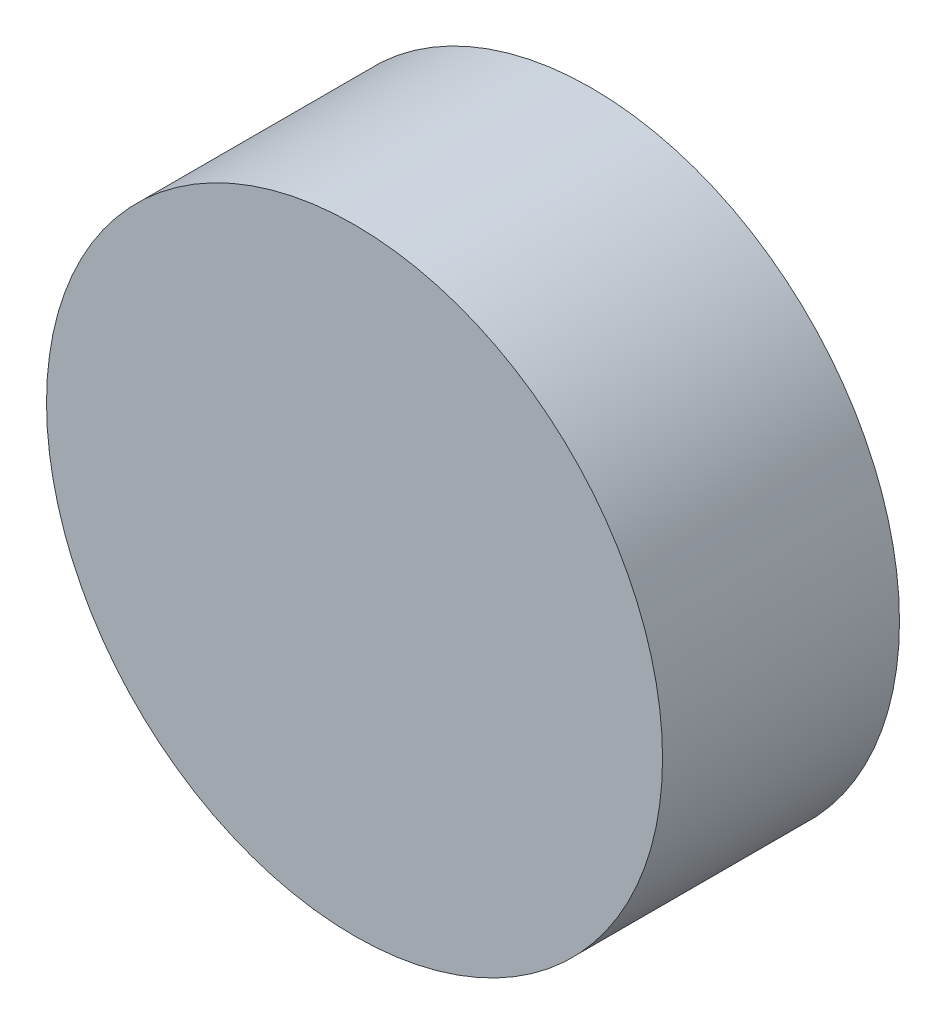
SolidWorks part; units mm, degrees
ref_plane "Front" through (0, 0, 0) normal (0, 0, 1) x (1, 0, 0)
ref_plane "Top" through (0, 0, 0) normal (0, 1, 0) x (1, 0, 0)
ref_plane "Right" through (0, 0, 0) normal (1, 0, 0) x (0, 0, -1)
sketch "Sketch1" plane through (0, 0, 0) normal (0, 0, 1) x (1, 0, 0)
  circle A0 centre (0, 0) radius 6.5
  dimension "D1" = 13
extrude "Extrude1" add sketch "Sketch1" along normal blind 5
hole_wizard "M2x0.4 Tapped Hole1" positions "Sketch3" profile "Sketch2" tap size "M2x0.4" standard "Ansi Metric"
sketch "Sketch3" plane through (0, 0, 0) normal (0, 0, -1) x (-1, 0, 0)
  point P0 (0, 4.9)
  dimension "D1" = 4.9
sketch "Sketch2" plane through (0, 4.9, 0) normal (1, 0, 0) x (0, 1, 0)
  line L0 (0, 0) -> (0, 4.6807)
  line L1 (0, 4.6807) -> (0.8, 4.2)
  line L2 (0.8, 4.2) -> (0.8, 0)
  line L5 (0.8, 0) -> (0, 0)
  line L10 (0, 4.6807) -> (-0.8, 4.2) construction
  line L11 (0, -6.35) -> (0, 107.95) construction
  dimension "Tap Drill Dia." = 1.6
  dimension "Tap Drill Depth" = 4.2
  dimension "Drill Angle" = 118
pattern_circular "CirPattern1" count 3 over 360
sketch "Sketch4" plane through (0, 0, 0) normal (0, 0, -1) x (-1, 0, 0)
  circle A0 centre (4.2543, 0) radius 1
  dimension "D1" = 2
extrude "Cut-Extrude1" cut sketch "Sketch4" against normal blind 2.5
pattern_circular "CirPattern2" count 3 over 360
sketch "Sketch5" plane through (0, 0, 0) normal (0, 0, -1) x (-1, 0, 0)
  circle A0 centre (0, 0) radius 2.5
  dimension "D1" = 5
extrude "Cut-Extrude2" cut sketch "Sketch5" against normal blind 1.7
chamfer "Chamfer1" distance 0.2 angle 45
